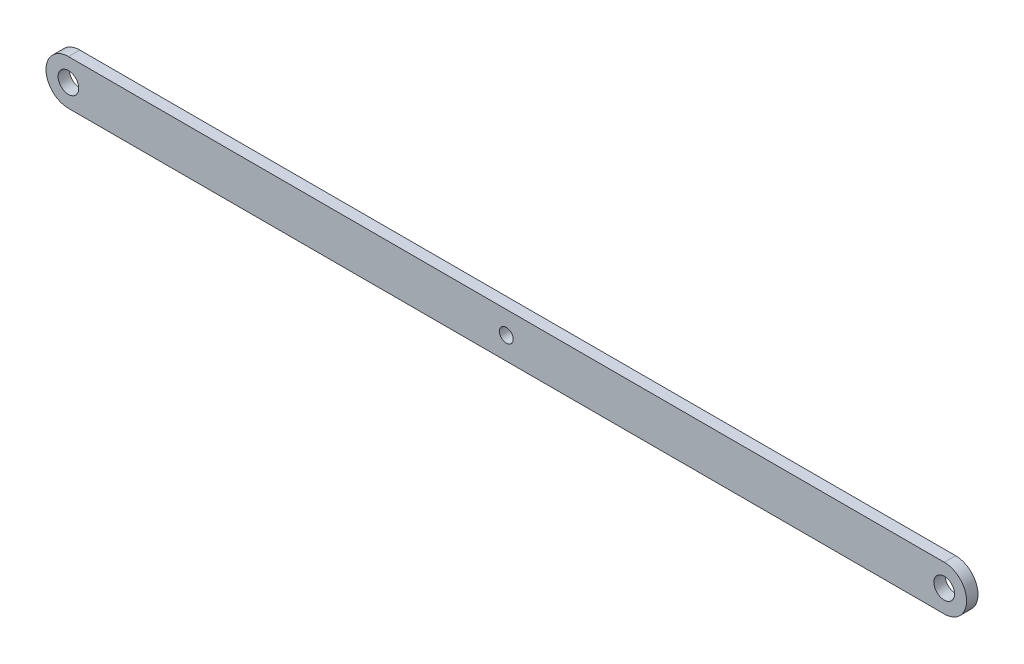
SolidWorks part; units mm, degrees
ref_plane "Front" through (0, 0, 0) normal (0, 0, 1) x (1, 0, 0)
ref_plane "Top" through (0, 0, 0) normal (0, 1, 0) x (1, 0, 0)
ref_plane "Right" through (0, 0, 0) normal (1, 0, 0) x (0, 0, -1)
sketch "Esquisse1" plane through (0, 0, 0) normal (0, 0, 1) x (1, 0, 0)
  line L0 (0, 0) -> (254, 0) construction
  line L1 (0, 0) -> (254, 0) construction
  line L2 (0, 6.5) -> (254, 6.5)
  line L3 (0, -6.5) -> (254, -6.5)
  arc A0 (0, 6.5) -> (0, -6.5) centre (0, 0) ccw
  arc A1 (254, -6.5) -> (254, 6.5) centre (254, 0) ccw
  circle A2 centre (0, 0) radius 3
  circle A3 centre (254, 0) radius 3
  circle A4 centre (127, 0) radius 2
  point P3 (127, 0)
  dimension "D2" = 6.5
  dimension "D3" = 6
  dimension "D4" = 6
  dimension "D5" = 4
  dimension "D1" = 254
extrude "Boss.-Extru.1" add sketch "Esquisse1" along normal blind 3.3
sketch "Esquisse2" plane through (0, 0, 3.3) normal (0, 0, 1) x (1, 0, 0)
  point P0 (0, 0)
  point P1 (127, 0)
  point P3 (254, 0)
sketch "Esquisse3" plane through (0, 0, 0) normal (0, 0, -1) x (-1, 0, 0)
  point P0 (0, 0)
  point P1 (-127, 0)
  point P3 (-254, 0)
